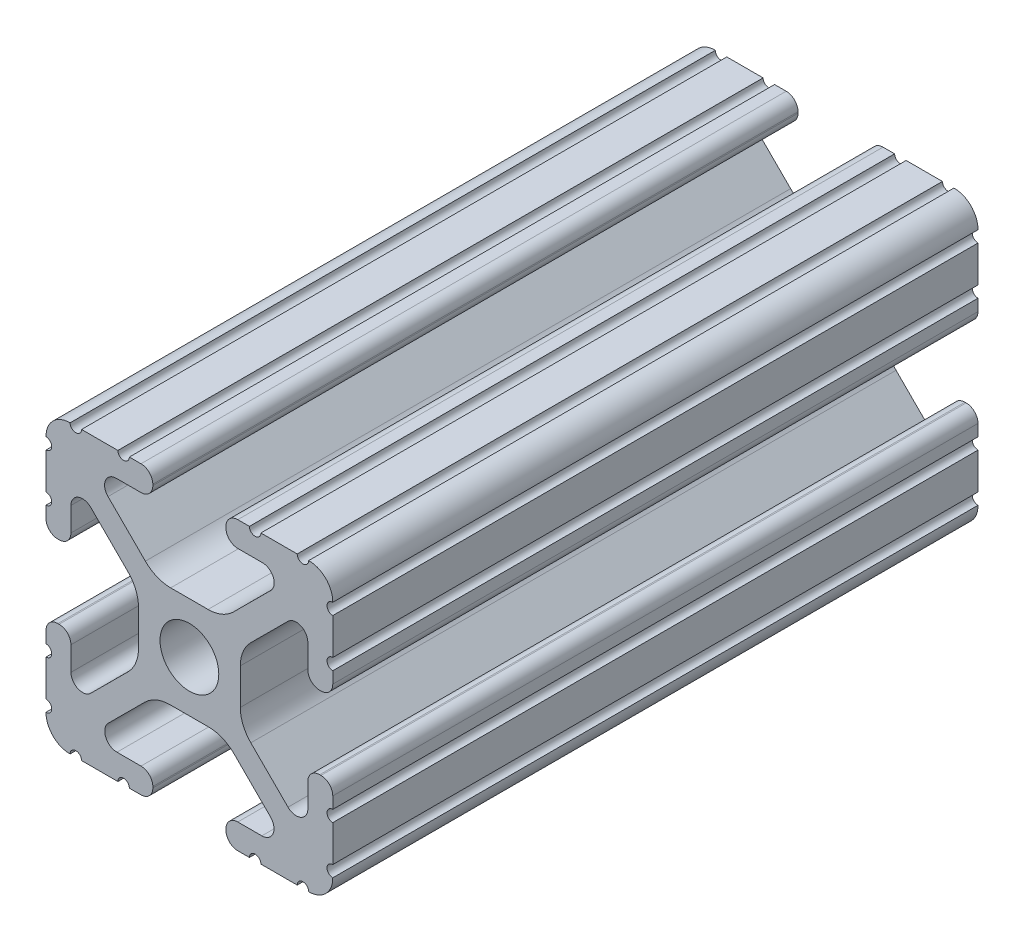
SolidWorks part; units mm, degrees
ref_plane "Front" through (0, 0, 0) normal (0, 0, 1) x (1, 0, 0)
ref_plane "Top" through (0, 0, 0) normal (0, 1, 0) x (1, 0, 0)
ref_plane "Right" through (0, 0, 0) normal (1, 0, 0) x (0, 0, -1)
sketch "Sketch1" plane through (0, 0, 0) normal (0, 0, 1) x (1, 0, 0)
  line L0 (-7.5107, 9.4563) -> (7.5107, 9.4563) construction
  line L1 (-7.4968, -9.4098) -> (7.4968, -9.4098) construction
  line L88 (-7.1797, -8.6452) -> (-3.9523, -5.4237)
  line L89 (-1.7093, -4.4958) -> (1.7093, -4.4958)
  line L90 (3.9523, -5.4237) -> (7.1797, -8.6452)
  line L91 (6.4164, -10.4902) -> (4.2875, -10.4902)
  line L92 (3.2385, -11.5392) -> (3.2385, -11.651)
  line L93 (4.2875, -12.7) -> (5.3171, -12.7)
  line L94 (6.3331, -12.7) -> (9.5504, -12.7)
  line L95 (12.7, -9.5504) -> (12.7, -6.3331)
  line L96 (12.7, -5.3171) -> (12.7, -4.2875)
  line L97 (11.651, -3.2385) -> (11.5392, -3.2385)
  line L98 (10.4902, -4.2875) -> (10.4902, -6.4021)
  line L99 (8.7371, -7.1294) -> (5.441, -3.8408)
  line L100 (4.5085, -1.5932) -> (4.5085, 1.5932)
  line L101 (5.441, 3.8408) -> (8.7371, 7.1294)
  line L102 (10.4902, 6.4021) -> (10.4902, 4.2875)
  line L103 (11.5392, 3.2385) -> (11.651, 3.2385)
  line L104 (12.7, 4.2875) -> (12.7, 5.3171)
  line L105 (12.7, 6.3331) -> (12.7, 9.5504)
  line L106 (9.5504, 12.7) -> (6.3331, 12.7)
  line L107 (5.3171, 12.7) -> (4.2875, 12.7)
  line L108 (3.2385, 11.651) -> (3.2385, 11.5392)
  line L109 (4.2875, 10.4902) -> (6.4768, 10.4902)
  line L110 (7.207, 8.7244) -> (3.8983, 5.4232)
  line L111 (1.6558, 4.4958) -> (-1.6558, 4.4958)
  line L112 (-3.8983, 5.4232) -> (-7.207, 8.7244)
  line L113 (-6.4768, 10.4902) -> (-4.2875, 10.4902)
  line L114 (-3.2385, 11.5392) -> (-3.2385, 11.651)
  line L115 (-4.2875, 12.7) -> (-5.3171, 12.7)
  line L116 (-6.3331, 12.7) -> (-9.5504, 12.7)
  line L117 (-12.7, 9.5504) -> (-12.7, 6.3331)
  line L118 (-12.7, 5.3171) -> (-12.7, 4.2875)
  line L119 (-11.651, 3.2385) -> (-11.5392, 3.2385)
  line L120 (-10.4902, 4.2875) -> (-10.4902, 6.4021)
  line L121 (-8.7371, 7.1294) -> (-5.441, 3.8408)
  line L122 (-4.5085, 1.5932) -> (-4.5085, -1.5932)
  line L123 (-5.441, -3.8408) -> (-8.7371, -7.1294)
  line L124 (-10.4902, -6.4021) -> (-10.4902, -4.2875)
  line L125 (-11.5392, -3.2385) -> (-11.651, -3.2385)
  line L126 (-12.7, -4.2875) -> (-12.7, -5.3171)
  line L127 (-12.7, -6.3331) -> (-12.7, -9.5504)
  line L128 (-9.5504, -12.7) -> (-6.3331, -12.7)
  line L129 (-5.3171, -12.7) -> (-4.2875, -12.7)
  line L130 (-3.2385, -11.651) -> (-3.2385, -11.5392)
  line L131 (-4.2875, -10.4902) -> (-6.4164, -10.4902)
  circle A1 centre (0, 0) radius 2.6035
  arc A104 (-7.1797, -8.6452) -> (-6.4164, -10.4902) centre (-6.4164, -9.4098) ccw
  arc A105 (-1.7093, -4.4958) -> (-3.9523, -5.4237) centre (-1.7093, -7.6708) ccw
  arc A106 (3.9523, -5.4237) -> (1.7093, -4.4958) centre (1.7093, -7.6708) ccw
  arc A107 (6.4164, -10.4902) -> (7.1797, -8.6452) centre (6.4164, -9.4098) ccw
  arc A108 (4.2875, -10.4902) -> (3.2385, -11.5392) centre (4.2875, -11.5392) ccw
  arc A109 (3.2385, -11.651) -> (4.2875, -12.7) centre (4.2875, -11.651) ccw
  arc A110 (6.3331, -12.7) -> (5.3171, -12.7) centre (5.8251, -12.7) ccw
  arc A111 (10.5664, -12.6998) -> (9.5504, -12.7) centre (10.0584, -12.7) ccw
  arc A112 (10.5664, -12.6998) -> (12.6998, -10.5664) centre (10.5918, -10.5918) ccw
  arc A113 (12.7, -9.5504) -> (12.6998, -10.5664) centre (12.7, -10.0584) ccw
  arc A114 (12.7, -5.3171) -> (12.7, -6.3331) centre (12.7, -5.8251) ccw
  arc A115 (12.7, -4.2875) -> (11.651, -3.2385) centre (11.651, -4.2875) ccw
  arc A116 (11.5392, -3.2385) -> (10.4902, -4.2875) centre (11.5392, -4.2875) ccw
  arc A117 (8.7371, -7.1294) -> (10.4902, -6.4021) centre (9.4628, -6.4021) ccw
  arc A118 (4.5085, -1.5932) -> (5.441, -3.8408) centre (7.6835, -1.5932) ccw
  arc A119 (5.441, 3.8408) -> (4.5085, 1.5932) centre (7.6835, 1.5932) ccw
  arc A120 (10.4902, 6.4021) -> (8.7371, 7.1294) centre (9.4628, 6.4021) ccw
  arc A121 (10.4902, 4.2875) -> (11.5392, 3.2385) centre (11.5392, 4.2875) ccw
  arc A122 (11.651, 3.2385) -> (12.7, 4.2875) centre (11.651, 4.2875) ccw
  arc A123 (12.7, 6.3331) -> (12.7, 5.3171) centre (12.7, 5.8251) ccw
  arc A124 (12.6998, 10.5664) -> (12.7, 9.5504) centre (12.7, 10.0584) ccw
  arc A125 (12.6998, 10.5664) -> (10.5664, 12.6998) centre (10.5918, 10.5918) ccw
  arc A126 (9.5504, 12.7) -> (10.5664, 12.6998) centre (10.0584, 12.7) ccw
  arc A127 (5.3171, 12.7) -> (6.3331, 12.7) centre (5.8251, 12.7) ccw
  arc A128 (4.2875, 12.7) -> (3.2385, 11.651) centre (4.2875, 11.651) ccw
  arc A129 (3.2385, 11.5392) -> (4.2875, 10.4902) centre (4.2875, 11.5392) ccw
  arc A130 (7.207, 8.7244) -> (6.4768, 10.4902) centre (6.4768, 9.4563) ccw
  arc A131 (1.6558, 4.4958) -> (3.8983, 5.4232) centre (1.6558, 7.6708) ccw
  arc A132 (-3.8983, 5.4232) -> (-1.6558, 4.4958) centre (-1.6558, 7.6708) ccw
  arc A133 (-6.4768, 10.4902) -> (-7.207, 8.7244) centre (-6.4768, 9.4563) ccw
  arc A134 (-4.2875, 10.4902) -> (-3.2385, 11.5392) centre (-4.2875, 11.5392) ccw
  arc A135 (-3.2385, 11.651) -> (-4.2875, 12.7) centre (-4.2875, 11.651) ccw
  arc A136 (-6.3331, 12.7) -> (-5.3171, 12.7) centre (-5.8251, 12.7) ccw
  arc A137 (-10.5664, 12.6998) -> (-9.5504, 12.7) centre (-10.0584, 12.7) ccw
  arc A138 (-10.5664, 12.6998) -> (-12.6998, 10.5664) centre (-10.5918, 10.5918) ccw
  arc A139 (-12.7, 9.5504) -> (-12.6998, 10.5664) centre (-12.7, 10.0584) ccw
  arc A140 (-12.7, 5.3171) -> (-12.7, 6.3331) centre (-12.7, 5.8251) ccw
  arc A141 (-12.7, 4.2875) -> (-11.651, 3.2385) centre (-11.651, 4.2875) ccw
  arc A142 (-11.5392, 3.2385) -> (-10.4902, 4.2875) centre (-11.5392, 4.2875) ccw
  arc A143 (-8.7371, 7.1294) -> (-10.4902, 6.4021) centre (-9.4628, 6.4021) ccw
  arc A144 (-4.5085, 1.5932) -> (-5.441, 3.8408) centre (-7.6835, 1.5932) ccw
  arc A145 (-5.441, -3.8408) -> (-4.5085, -1.5932) centre (-7.6835, -1.5932) ccw
  arc A146 (-10.4902, -6.4021) -> (-8.7371, -7.1294) centre (-9.4628, -6.4021) ccw
  arc A147 (-10.4902, -4.2875) -> (-11.5392, -3.2385) centre (-11.5392, -4.2875) ccw
  arc A148 (-11.651, -3.2385) -> (-12.7, -4.2875) centre (-11.651, -4.2875) ccw
  arc A149 (-12.7, -6.3331) -> (-12.7, -5.3171) centre (-12.7, -5.8251) ccw
  arc A150 (-12.6998, -10.5664) -> (-12.7, -9.5504) centre (-12.7, -10.0584) ccw
  arc A151 (-12.6998, -10.5664) -> (-10.5664, -12.6998) centre (-10.5918, -10.5918) ccw
  arc A152 (-9.5504, -12.7) -> (-10.5664, -12.6998) centre (-10.0584, -12.7) ccw
  arc A153 (-5.3171, -12.7) -> (-6.3331, -12.7) centre (-5.8251, -12.7) ccw
  arc A154 (-4.2875, -12.7) -> (-3.2385, -11.651) centre (-4.2875, -11.651) ccw
  arc A155 (-3.2385, -11.5392) -> (-4.2875, -10.4902) centre (-4.2875, -11.5392) ccw
extrude "Boss-Extrude1" add sketch "Sketch1" along normal mid plane 57.15
